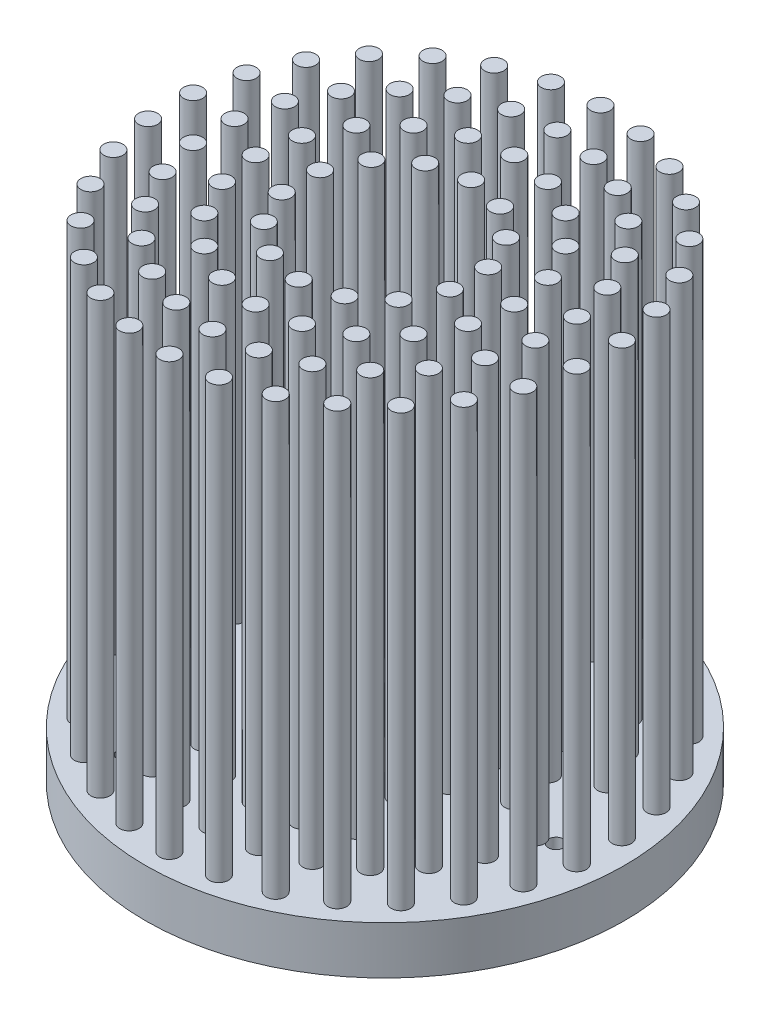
SolidWorks part; units mm, degrees
ref_plane "前基準面" through (0, 0, 0) normal (0, 0, 1) x (1, 0, 0)
ref_plane "上基準面" through (0, 0, 0) normal (0, 1, 0) x (1, 0, 0)
ref_plane "右基準面" through (0, 0, 0) normal (1, 0, 0) x (0, 0, -1)
sketch "草圖1" plane through (0, 0, 0) normal (0, 1, 0) x (1, 0, 0)
  circle A0 centre (0, 0) radius 25
  dimension "D1" = 50
extrude "填料-伸長1" add sketch "草圖1" along normal blind 3
sketch "草圖2" plane through (0, 3, 0) normal (0, 1, 0) x (1, 0, 0)
  line L0 (0, 0) -> (0, 50000) construction
  circle A0 centre (0, 0) radius 1
  circle A1 centre (0, -4.5) radius 1
  circle A2 centre (0, -9) radius 1
  circle A3 centre (0, -13.5) radius 1
  circle A4 centre (0, -18) radius 1
  circle A5 centre (-4.3077, -17.477) radius 1
  circle A6 centre (-8.365, -15.9382) radius 1
  circle A7 centre (-11.9362, -13.4732) radius 1
  circle A8 centre (-14.8137, -10.2252) radius 1
  circle A9 centre (-16.8303, -6.3829) radius 1
  circle A10 centre (-17.8688, -2.1697) radius 1
  circle A11 centre (-17.8688, 2.1697) radius 1
  circle A12 centre (-16.8303, 6.3829) radius 1
  circle A13 centre (-14.8137, 10.2252) radius 1
  circle A14 centre (-11.9362, 13.4732) radius 1
  circle A15 centre (-8.365, 15.9382) radius 1
  circle A16 centre (-4.3077, 17.477) radius 1
  circle A17 centre (0, 18) radius 1
  circle A18 centre (4.3077, 17.477) radius 1
  circle A19 centre (8.365, 15.9382) radius 1
  circle A20 centre (11.9362, 13.4732) radius 1
  circle A21 centre (14.8137, 10.2252) radius 1
  circle A22 centre (16.8303, 6.3829) radius 1
  circle A23 centre (17.8688, 2.1697) radius 1
  circle A24 centre (17.8688, -2.1697) radius 1
  circle A25 centre (16.8303, -6.3829) radius 1
  circle A26 centre (14.8137, -10.2252) radius 1
  circle A27 centre (11.9362, -13.4732) radius 1
  circle A28 centre (8.365, -15.9382) radius 1
  circle A29 centre (4.3077, -17.477) radius 1
  circle A30 centre (-4.1717, -12.8393) radius 1
  circle A31 centre (-7.9351, -10.9217) radius 1
  circle A32 centre (-10.9217, -7.9351) radius 1
  circle A33 centre (-12.8393, -4.1717) radius 1
  circle A34 centre (-13.5, 0) radius 1
  circle A35 centre (-12.8393, 4.1717) radius 1
  circle A36 centre (-10.9217, 7.9351) radius 1
  circle A37 centre (-7.9351, 10.9217) radius 1
  circle A38 centre (-4.1717, 12.8393) radius 1
  circle A39 centre (0, 13.5) radius 1
  circle A40 centre (4.1717, 12.8393) radius 1
  circle A41 centre (7.9351, 10.9217) radius 1
  circle A42 centre (10.9217, 7.9351) radius 1
  circle A43 centre (12.8393, 4.1717) radius 1
  circle A44 centre (13.5, 0) radius 1
  circle A45 centre (12.8393, -4.1717) radius 1
  circle A46 centre (10.9217, -7.9351) radius 1
  circle A47 centre (7.9351, -10.9217) radius 1
  circle A48 centre (4.1717, -12.8393) radius 1
  circle A49 centre (-3.905, -8.1087) radius 1
  circle A50 centre (-7.0365, -5.6114) radius 1
  circle A51 centre (-8.7744, -2.0027) radius 1
  circle A52 centre (-8.7744, 2.0027) radius 1
  circle A53 centre (-7.0365, 5.6114) radius 1
  circle A54 centre (-3.905, 8.1087) radius 1
  circle A55 centre (0, 9) radius 1
  circle A56 centre (3.905, 8.1087) radius 1
  circle A57 centre (7.0365, 5.6114) radius 1
  circle A58 centre (8.7744, 2.0027) radius 1
  circle A59 centre (8.7744, -2.0027) radius 1
  circle A60 centre (7.0365, -5.6114) radius 1
  circle A61 centre (3.905, -8.1087) radius 1
  circle A62 centre (-3.5182, -2.8057) radius 1
  circle A63 centre (-4.3872, 1.0013) radius 1
  circle A64 centre (-1.9525, 4.0544) radius 1
  circle A65 centre (1.9525, 4.0544) radius 1
  circle A66 centre (4.3872, 1.0013) radius 1
  circle A67 centre (3.5182, -2.8057) radius 1
  circle A68 centre (0, 22.5) radius 1
  circle A69 centre (4.678, 22.0083) radius 1
  circle A70 centre (9.1516, 20.5548) radius 1
  circle A71 centre (13.2252, 18.2029) radius 1
  circle A72 centre (16.7208, 15.0554) radius 1
  circle A73 centre (19.4856, 11.25) radius 1
  circle A74 centre (21.3988, 6.9529) radius 1
  circle A75 centre (22.3767, 2.3519) radius 1
  circle A76 centre (22.3767, -2.3519) radius 1
  circle A77 centre (21.3988, -6.9529) radius 1
  circle A78 centre (19.4856, -11.25) radius 1
  circle A79 centre (16.7208, -15.0554) radius 1
  circle A80 centre (13.2252, -18.2029) radius 1
  circle A81 centre (9.1516, -20.5548) radius 1
  circle A82 centre (4.678, -22.0083) radius 1
  circle A83 centre (0, -22.5) radius 1
  circle A84 centre (-4.678, -22.0083) radius 1
  circle A85 centre (-9.1516, -20.5548) radius 1
  circle A86 centre (-13.2252, -18.2029) radius 1
  circle A87 centre (-16.7208, -15.0554) radius 1
  circle A88 centre (-19.4856, -11.25) radius 1
  circle A89 centre (-21.3988, -6.9529) radius 1
  circle A90 centre (-22.3767, -2.3519) radius 1
  circle A91 centre (-22.3767, 2.3519) radius 1
  circle A92 centre (-21.3988, 6.9529) radius 1
  circle A93 centre (-19.4856, 11.25) radius 1
  circle A94 centre (-16.7208, 15.0554) radius 1
  circle A95 centre (-13.2252, 18.2029) radius 1
  circle A96 centre (-9.1516, 20.5548) radius 1
  circle A97 centre (-4.678, 22.0083) radius 1
  dimension "D1" = 5
  dimension "D4" = 26
  dimension "D3" = 4
  dimension "D6" = 30
  dimension "D7" = 20
  dimension "D2" = 5
  dimension "D5" = 4.5
extrude "填料-伸長2" add sketch "草圖2" along normal blind 27
sketch "草圖3" [suppressed] plane through (0, 3, 0) normal (0, 1, 0) x (1, 0, 0)
  circle A1 centre (0, 0) radius 25
  circle A2 centre (0, 0) radius 25
  dimension "D1" = 0
extrude "填料-伸長3" [suppressed] add sketch "草圖3" along normal blind 2
sketch "草圖4" plane through (0, 3, 0) normal (0, 1, 0) x (1, 0, 0)
  circle A1 centre (0, 22.5) radius 1
  circle A2 centre (0, 22.5) radius 1
  circle A3 centre (-4.3077, -17.477) radius 1
  circle A4 centre (-4.3077, -17.477) radius 1
  circle A5 centre (0, -18) radius 1
  circle A6 centre (0, -18) radius 1
  circle A7 centre (0, -13.5) radius 1
  circle A8 centre (0, -13.5) radius 1
  circle A9 centre (0, -9) radius 1
  circle A10 centre (0, -9) radius 1
  circle A11 centre (0, -4.5) radius 1
  circle A12 centre (0, -4.5) radius 1
  circle A13 centre (0, 0) radius 1
  circle A14 centre (0, 0) radius 1
  circle A15 centre (-14.8137, 10.2252) radius 1
  circle A16 centre (-14.8137, 10.2252) radius 1
  circle A17 centre (-16.8303, 6.3829) radius 1
  circle A18 centre (-16.8303, 6.3829) radius 1
  circle A19 centre (-17.8688, 2.1697) radius 1
  circle A20 centre (-17.8688, 2.1697) radius 1
  circle A21 centre (-17.8688, -2.1697) radius 1
  circle A22 centre (-17.8688, -2.1697) radius 1
  circle A23 centre (-16.8303, -6.3829) radius 1
  circle A24 centre (-16.8303, -6.3829) radius 1
  circle A25 centre (-14.8137, -10.2252) radius 1
  circle A26 centre (-14.8137, -10.2252) radius 1
  circle A27 centre (-11.9362, -13.4732) radius 1
  circle A28 centre (-11.9362, -13.4732) radius 1
  circle A29 centre (-8.365, -15.9382) radius 1
  circle A30 centre (-8.365, -15.9382) radius 1
  circle A31 centre (14.8137, 10.2252) radius 1
  circle A32 centre (14.8137, 10.2252) radius 1
  circle A33 centre (11.9362, 13.4732) radius 1
  circle A34 centre (11.9362, 13.4732) radius 1
  circle A35 centre (8.365, 15.9382) radius 1
  circle A36 centre (8.365, 15.9382) radius 1
  circle A37 centre (4.3077, 17.477) radius 1
  circle A38 centre (4.3077, 17.477) radius 1
  circle A39 centre (0, 18) radius 1
  circle A40 centre (0, 18) radius 1
  circle A41 centre (-4.3077, 17.477) radius 1
  circle A42 centre (-4.3077, 17.477) radius 1
  circle A43 centre (-8.365, 15.9382) radius 1
  circle A44 centre (-8.365, 15.9382) radius 1
  circle A45 centre (-11.9362, 13.4732) radius 1
  circle A46 centre (-11.9362, 13.4732) radius 1
  circle A47 centre (4.3077, -17.477) radius 1
  circle A48 centre (4.3077, -17.477) radius 1
  circle A49 centre (8.365, -15.9382) radius 1
  circle A50 centre (8.365, -15.9382) radius 1
  circle A51 centre (11.9362, -13.4732) radius 1
  circle A52 centre (11.9362, -13.4732) radius 1
  circle A53 centre (14.8137, -10.2252) radius 1
  circle A54 centre (14.8137, -10.2252) radius 1
  circle A55 centre (16.8303, -6.3829) radius 1
  circle A56 centre (16.8303, -6.3829) radius 1
  circle A57 centre (17.8688, -2.1697) radius 1
  circle A58 centre (17.8688, -2.1697) radius 1
  circle A59 centre (17.8688, 2.1697) radius 1
  circle A60 centre (17.8688, 2.1697) radius 1
  circle A61 centre (16.8303, 6.3829) radius 1
  circle A62 centre (16.8303, 6.3829) radius 1
  circle A63 centre (-7.9351, 10.9217) radius 1
  circle A64 centre (-7.9351, 10.9217) radius 1
  circle A65 centre (-10.9217, 7.9351) radius 1
  circle A66 centre (-10.9217, 7.9351) radius 1
  circle A67 centre (-12.8393, 4.1717) radius 1
  circle A68 centre (-12.8393, 4.1717) radius 1
  circle A69 centre (-13.5, 0) radius 1
  circle A70 centre (-13.5, 0) radius 1
  circle A71 centre (-12.8393, -4.1717) radius 1
  circle A72 centre (-12.8393, -4.1717) radius 1
  circle A73 centre (-10.9217, -7.9351) radius 1
  circle A74 centre (-10.9217, -7.9351) radius 1
  circle A75 centre (-7.9351, -10.9217) radius 1
  circle A76 centre (-7.9351, -10.9217) radius 1
  circle A77 centre (-4.1717, -12.8393) radius 1
  circle A78 centre (-4.1717, -12.8393) radius 1
  circle A79 centre (12.8393, -4.1717) radius 1
  circle A80 centre (12.8393, -4.1717) radius 1
  circle A81 centre (13.5, 0) radius 1
  circle A82 centre (13.5, 0) radius 1
  circle A83 centre (12.8393, 4.1717) radius 1
  circle A84 centre (12.8393, 4.1717) radius 1
  circle A85 centre (10.9217, 7.9351) radius 1
  circle A86 centre (10.9217, 7.9351) radius 1
  circle A87 centre (7.9351, 10.9217) radius 1
  circle A88 centre (7.9351, 10.9217) radius 1
  circle A89 centre (4.1717, 12.8393) radius 1
  circle A90 centre (4.1717, 12.8393) radius 1
  circle A91 centre (0, 13.5) radius 1
  circle A92 centre (0, 13.5) radius 1
  circle A93 centre (-4.1717, 12.8393) radius 1
  circle A94 centre (-4.1717, 12.8393) radius 1
  circle A95 centre (-7.0365, 5.6114) radius 1
  circle A96 centre (-7.0365, 5.6114) radius 1
  circle A97 centre (-8.7744, 2.0027) radius 1
  circle A98 centre (-8.7744, 2.0027) radius 1
  circle A99 centre (-8.7744, -2.0027) radius 1
  circle A100 centre (-8.7744, -2.0027) radius 1
  circle A101 centre (-7.0365, -5.6114) radius 1
  circle A102 centre (-7.0365, -5.6114) radius 1
  circle A103 centre (-3.905, -8.1087) radius 1
  circle A104 centre (-3.905, -8.1087) radius 1
  circle A105 centre (4.1717, -12.8393) radius 1
  circle A106 centre (4.1717, -12.8393) radius 1
  circle A107 centre (7.9351, -10.9217) radius 1
  circle A108 centre (7.9351, -10.9217) radius 1
  circle A109 centre (10.9217, -7.9351) radius 1
  circle A110 centre (10.9217, -7.9351) radius 1
  circle A111 centre (3.905, -8.1087) radius 1
  circle A112 centre (3.905, -8.1087) radius 1
  circle A113 centre (7.0365, -5.6114) radius 1
  circle A114 centre (7.0365, -5.6114) radius 1
  circle A115 centre (8.7744, -2.0027) radius 1
  circle A116 centre (8.7744, -2.0027) radius 1
  circle A117 centre (8.7744, 2.0027) radius 1
  circle A118 centre (8.7744, 2.0027) radius 1
  circle A119 centre (7.0365, 5.6114) radius 1
  circle A120 centre (7.0365, 5.6114) radius 1
  circle A121 centre (3.905, 8.1087) radius 1
  circle A122 centre (3.905, 8.1087) radius 1
  circle A123 centre (0, 9) radius 1
  circle A124 centre (0, 9) radius 1
  circle A125 centre (-3.905, 8.1087) radius 1
  circle A126 centre (-3.905, 8.1087) radius 1
  circle A127 centre (3.5182, -2.8057) radius 1
  circle A128 centre (3.5182, -2.8057) radius 1
  circle A129 centre (4.3872, 1.0013) radius 1
  circle A130 centre (4.3872, 1.0013) radius 1
  circle A131 centre (1.9525, 4.0544) radius 1
  circle A132 centre (1.9525, 4.0544) radius 1
  circle A133 centre (-1.9525, 4.0544) radius 1
  circle A134 centre (-1.9525, 4.0544) radius 1
  circle A135 centre (-4.3872, 1.0013) radius 1
  circle A136 centre (-4.3872, 1.0013) radius 1
  circle A137 centre (-3.5182, -2.8057) radius 1
  circle A138 centre (-3.5182, -2.8057) radius 1
  circle A139 centre (22.3767, -2.3519) radius 1
  circle A140 centre (22.3767, -2.3519) radius 1
  circle A141 centre (22.3767, 2.3519) radius 1
  circle A142 centre (22.3767, 2.3519) radius 1
  circle A143 centre (21.3988, 6.9529) radius 1
  circle A144 centre (21.3988, 6.9529) radius 1
  circle A145 centre (19.4856, 11.25) radius 1
  circle A146 centre (19.4856, 11.25) radius 1
  circle A147 centre (16.7208, 15.0554) radius 1
  circle A148 centre (16.7208, 15.0554) radius 1
  circle A149 centre (13.2252, 18.2029) radius 1
  circle A150 centre (13.2252, 18.2029) radius 1
  circle A151 centre (9.1516, 20.5548) radius 1
  circle A152 centre (9.1516, 20.5548) radius 1
  circle A153 centre (4.678, 22.0083) radius 1
  circle A154 centre (4.678, 22.0083) radius 1
  circle A155 centre (-4.678, -22.0083) radius 1
  circle A156 centre (-4.678, -22.0083) radius 1
  circle A157 centre (0, -22.5) radius 1
  circle A158 centre (0, -22.5) radius 1
  circle A159 centre (4.678, -22.0083) radius 1
  circle A160 centre (4.678, -22.0083) radius 1
  circle A161 centre (9.1516, -20.5548) radius 1
  circle A162 centre (9.1516, -20.5548) radius 1
  circle A163 centre (13.2252, -18.2029) radius 1
  circle A164 centre (13.2252, -18.2029) radius 1
  circle A165 centre (16.7208, -15.0554) radius 1
  circle A166 centre (16.7208, -15.0554) radius 1
  circle A167 centre (19.4856, -11.25) radius 1
  circle A168 centre (19.4856, -11.25) radius 1
  circle A169 centre (21.3988, -6.9529) radius 1
  circle A170 centre (21.3988, -6.9529) radius 1
  circle A171 centre (-21.3988, 6.9529) radius 1
  circle A172 centre (-21.3988, 6.9529) radius 1
  circle A173 centre (-22.3767, 2.3519) radius 1
  circle A174 centre (-22.3767, 2.3519) radius 1
  circle A175 centre (-22.3767, -2.3519) radius 1
  circle A176 centre (-22.3767, -2.3519) radius 1
  circle A177 centre (-21.3988, -6.9529) radius 1
  circle A178 centre (-21.3988, -6.9529) radius 1
  circle A179 centre (-19.4856, -11.25) radius 1
  circle A180 centre (-19.4856, -11.25) radius 1
  circle A181 centre (-16.7208, -15.0554) radius 1
  circle A182 centre (-16.7208, -15.0554) radius 1
  circle A183 centre (-13.2252, -18.2029) radius 1
  circle A184 centre (-13.2252, -18.2029) radius 1
  circle A185 centre (-9.1516, -20.5548) radius 1
  circle A186 centre (-9.1516, -20.5548) radius 1
  circle A187 centre (-4.678, 22.0083) radius 1
  circle A188 centre (-4.678, 22.0083) radius 1
  circle A189 centre (-9.1516, 20.5548) radius 1
  circle A190 centre (-9.1516, 20.5548) radius 1
  circle A191 centre (-13.2252, 18.2029) radius 1
  circle A192 centre (-13.2252, 18.2029) radius 1
  circle A193 centre (-16.7208, 15.0554) radius 1
  circle A194 centre (-16.7208, 15.0554) radius 1
  circle A195 centre (-19.4856, 11.25) radius 1
  circle A196 centre (-19.4856, 11.25) radius 1
  dimension "D1" = 0
  dimension "D2" = 0
  dimension "D3" = 0
  dimension "D4" = 0
  dimension "D5" = 0
  dimension "D6" = 0
  dimension "D7" = 0
  dimension "D8" = 0
  dimension "D9" = 0
  dimension "D10" = 0
  dimension "D11" = 0
  dimension "D12" = 0
  dimension "D13" = 0
  dimension "D14" = 0
  dimension "D15" = 0
  dimension "D16" = 0
  dimension "D17" = 0
  dimension "D18" = 0
  dimension "D19" = 0
  dimension "D20" = 0
  dimension "D21" = 0
  dimension "D22" = 0
  dimension "D23" = 0
  dimension "D24" = 0
  dimension "D25" = 0
  dimension "D26" = 0
  dimension "D27" = 0
  dimension "D28" = 0
  dimension "D29" = 0
  dimension "D30" = 0
  dimension "D31" = 0
  dimension "D32" = 0
  dimension "D33" = 0
  dimension "D34" = 0
  dimension "D35" = 0
  dimension "D36" = 0
  dimension "D37" = 0
  dimension "D38" = 0
  dimension "D39" = 0
  dimension "D40" = 0
  dimension "D41" = 0
  dimension "D42" = 0
  dimension "D43" = 0
  dimension "D44" = 0
  dimension "D45" = 0
  dimension "D46" = 0
  dimension "D47" = 0
  dimension "D48" = 0
  dimension "D49" = 0
  dimension "D50" = 0
  dimension "D51" = 0
  dimension "D52" = 0
  dimension "D53" = 0
  dimension "D54" = 0
  dimension "D55" = 0
  dimension "D56" = 0
  dimension "D57" = 0
  dimension "D58" = 0
  dimension "D59" = 0
  dimension "D60" = 0
  dimension "D61" = 0
  dimension "D62" = 0
  dimension "D63" = 0
  dimension "D64" = 0
  dimension "D65" = 0
  dimension "D66" = 0
  dimension "D67" = 0
  dimension "D68" = 0
  dimension "D69" = 0
  dimension "D70" = 0
  dimension "D71" = 0
  dimension "D72" = 0
  dimension "D73" = 0
  dimension "D74" = 0
  dimension "D75" = 0
  dimension "D76" = 0
  dimension "D77" = 0
  dimension "D78" = 0
  dimension "D79" = 0
  dimension "D80" = 0
  dimension "D81" = 0
  dimension "D82" = 0
  dimension "D83" = 0
  dimension "D84" = 0
  dimension "D85" = 0
  dimension "D86" = 0
  dimension "D87" = 0
  dimension "D88" = 0
  dimension "D89" = 0
  dimension "D90" = 0
  dimension "D91" = 0
  dimension "D92" = 0
  dimension "D93" = 0
  dimension "D94" = 0
  dimension "D95" = 0
  dimension "D96" = 0
  dimension "D97" = 0
  dimension "D98" = 0
extrude "填料-伸長4" [suppressed] add sketch "草圖4" along normal blind 37
sketch "草圖5" plane through (0, 3, 0) normal (0, 1, 0) x (1, 0, 0)
  circle A1 centre (0, 0) radius 25
  circle A2 centre (0, 0) radius 25
  dimension "D1" = 0
extrude "填料-伸長5" add sketch "草圖5" along normal blind 2
sketch "草圖7" [suppressed] plane through (0, 3, 0) normal (0, 1, 0) x (1, 0, 0)
  circle A1 centre (0, 0) radius 25
  circle A2 centre (0, 0) radius 25
  dimension "D1" = 0
extrude "填料-伸長7" [suppressed] add sketch "草圖7" along normal blind 2
fillet "圓角1" [suppressed] radius 0.2
fillet "圓角2" [suppressed] radius 0.2
fillet "圓角3" [suppressed] radius 0.2
fillet "圓角5" [suppressed] radius 0.2
fillet "圓角6" [suppressed] radius 0.2
hole_wizard "M2x0.4 Tapped Hole1" positions "Sketch3" profile "Sketch2" tap size "M2x0.4" standard "Ansi 公制"
sketch "Sketch3" plane through (0, 0, 0) normal (0, -1, 0) x (1, 0, 0)
  line L0 (0, 0) -> (-8.3595, -17.6173) construction
  line L2 (0, 0) -> (19.4368, 1.5691) construction
  line L4 (0, 0) -> (-11.0773, 16.0482) construction
  line L5 (-8.365, 15.9382) -> (-11.9362, 13.4732) construction
  line L7 (-10.1506, 14.7057) -> (-11.9362, 17.2926) construction
  circle A0 centre (0, 0) radius 19.5 construction
  point P0 (-11.0773, 16.0482)
  point P1 (19.4368, 1.5691)
  point P4 (-8.3595, -17.6173)
  dimension "D3" = 39
  dimension "D1" = 120
  dimension "D2" = 120
sketch "Sketch2" plane through (-11.0773, 0, 16.0482) normal (1, 0, 0) x (0, 0, -1)
  line L0 (0, 0) -> (0, 6.4807)
  line L1 (0, 6.4807) -> (0.8, 6)
  line L2 (0.8, 6) -> (0.8, 0)
  line L5 (0.8, 0) -> (0, 0)
  line L10 (0, 6.4807) -> (-0.8, 6) construction
  line L11 (0, -6.35) -> (0, 107.95) construction
  dimension "螺孔鑽直徑" = 1.6
  dimension "螺孔鑽深度" = 6
  dimension "導頭角度" = 118
sketch "Sketch4" [suppressed] plane through (0, 5, 0) normal (0, 1, 0) x (1, 0, 0)
  circle A0 centre (-14.8137, 10.2252) radius 1
  circle A1 centre (14.8137, 10.2252) radius 1
  circle A2 centre (0, -18) radius 1
  arc A3 (-15.6405, 9.6627) -> (-15.8029, 10.3715) centre (-14.8137, 10.2252) ccw construction
  arc A4 (15.8029, 10.3715) -> (15.6405, 9.6627) centre (14.8137, 10.2252) ccw construction
  arc A7 (0.8268, -18.5625) -> (-0.8268, -18.5625) centre (0, -18) ccw construction
  circle A8 centre (0, -18) radius 1 construction
extrude "Extrude3" [suppressed] cut sketch "Sketch4" along normal through all
sketch "草圖6" plane through (0, 5, 0) normal (0, 1, 0) x (1, 0, 0)
  circle A1 centre (0, 22.5) radius 1
  circle A2 centre (0, 22.5) radius 1
  circle A3 centre (-4.3077, -17.477) radius 1
  circle A4 centre (-4.3077, -17.477) radius 1
  circle A5 centre (0, -18) radius 1
  circle A6 centre (0, -18) radius 1
  circle A7 centre (0, -13.5) radius 1
  circle A8 centre (0, -13.5) radius 1
  circle A9 centre (0, -9) radius 1
  circle A10 centre (0, -9) radius 1
  circle A11 centre (0, -4.5) radius 1
  circle A12 centre (0, -4.5) radius 1
  circle A13 centre (0, 0) radius 1
  circle A14 centre (0, 0) radius 1
  circle A15 centre (-14.8137, 10.2252) radius 1
  circle A16 centre (-14.8137, 10.2252) radius 1
  circle A17 centre (-16.8303, 6.3829) radius 1
  circle A18 centre (-16.8303, 6.3829) radius 1
  circle A19 centre (-17.8688, 2.1697) radius 1
  circle A20 centre (-17.8688, 2.1697) radius 1
  circle A21 centre (-17.8688, -2.1697) radius 1
  circle A22 centre (-17.8688, -2.1697) radius 1
  circle A23 centre (-16.8303, -6.3829) radius 1
  circle A24 centre (-16.8303, -6.3829) radius 1
  circle A25 centre (-14.8137, -10.2252) radius 1
  circle A26 centre (-14.8137, -10.2252) radius 1
  circle A27 centre (-11.9362, -13.4732) radius 1
  circle A28 centre (-11.9362, -13.4732) radius 1
  circle A29 centre (-8.365, -15.9382) radius 1
  circle A30 centre (-8.365, -15.9382) radius 1
  circle A31 centre (14.8137, 10.2252) radius 1
  circle A32 centre (14.8137, 10.2252) radius 1
  circle A33 centre (11.9362, 13.4732) radius 1
  circle A34 centre (11.9362, 13.4732) radius 1
  circle A35 centre (8.365, 15.9382) radius 1
  circle A36 centre (8.365, 15.9382) radius 1
  circle A37 centre (4.3077, 17.477) radius 1
  circle A38 centre (4.3077, 17.477) radius 1
  circle A39 centre (0, 18) radius 1
  circle A40 centre (0, 18) radius 1
  circle A41 centre (-4.3077, 17.477) radius 1
  circle A42 centre (-4.3077, 17.477) radius 1
  circle A43 centre (-8.365, 15.9382) radius 1
  circle A44 centre (-8.365, 15.9382) radius 1
  circle A45 centre (-11.9362, 13.4732) radius 1
  circle A46 centre (-11.9362, 13.4732) radius 1
  circle A47 centre (4.3077, -17.477) radius 1
  circle A48 centre (4.3077, -17.477) radius 1
  circle A49 centre (8.365, -15.9382) radius 1
  circle A50 centre (8.365, -15.9382) radius 1
  circle A51 centre (11.9362, -13.4732) radius 1
  circle A52 centre (11.9362, -13.4732) radius 1
  circle A53 centre (14.8137, -10.2252) radius 1
  circle A54 centre (14.8137, -10.2252) radius 1
  circle A55 centre (16.8303, -6.3829) radius 1
  circle A56 centre (16.8303, -6.3829) radius 1
  circle A57 centre (17.8688, -2.1697) radius 1
  circle A58 centre (17.8688, -2.1697) radius 1
  circle A59 centre (17.8688, 2.1697) radius 1
  circle A60 centre (17.8688, 2.1697) radius 1
  circle A61 centre (16.8303, 6.3829) radius 1
  circle A62 centre (16.8303, 6.3829) radius 1
  circle A63 centre (-7.9351, 10.9217) radius 1
  circle A64 centre (-7.9351, 10.9217) radius 1
  circle A65 centre (-10.9217, 7.9351) radius 1
  circle A66 centre (-10.9217, 7.9351) radius 1
  circle A67 centre (-12.8393, 4.1717) radius 1
  circle A68 centre (-12.8393, 4.1717) radius 1
  circle A69 centre (-13.5, 0) radius 1
  circle A70 centre (-13.5, 0) radius 1
  circle A71 centre (-12.8393, -4.1717) radius 1
  circle A72 centre (-12.8393, -4.1717) radius 1
  circle A73 centre (-10.9217, -7.9351) radius 1
  circle A74 centre (-10.9217, -7.9351) radius 1
  circle A75 centre (-7.9351, -10.9217) radius 1
  circle A76 centre (-7.9351, -10.9217) radius 1
  circle A77 centre (-4.1717, -12.8393) radius 1
  circle A78 centre (-4.1717, -12.8393) radius 1
  circle A79 centre (12.8393, -4.1717) radius 1
  circle A80 centre (12.8393, -4.1717) radius 1
  circle A81 centre (13.5, 0) radius 1
  circle A82 centre (13.5, 0) radius 1
  circle A83 centre (12.8393, 4.1717) radius 1
  circle A84 centre (12.8393, 4.1717) radius 1
  circle A85 centre (10.9217, 7.9351) radius 1
  circle A86 centre (10.9217, 7.9351) radius 1
  circle A87 centre (7.9351, 10.9217) radius 1
  circle A88 centre (7.9351, 10.9217) radius 1
  circle A89 centre (4.1717, 12.8393) radius 1
  circle A90 centre (4.1717, 12.8393) radius 1
  circle A91 centre (0, 13.5) radius 1
  circle A92 centre (0, 13.5) radius 1
  circle A93 centre (-4.1717, 12.8393) radius 1
  circle A94 centre (-4.1717, 12.8393) radius 1
  circle A95 centre (-7.0365, 5.6114) radius 1
  circle A96 centre (-7.0365, 5.6114) radius 1
  circle A97 centre (-8.7744, 2.0027) radius 1
  circle A98 centre (-8.7744, 2.0027) radius 1
  circle A99 centre (-8.7744, -2.0027) radius 1
  circle A100 centre (-8.7744, -2.0027) radius 1
  circle A101 centre (-7.0365, -5.6114) radius 1
  circle A102 centre (-7.0365, -5.6114) radius 1
  circle A103 centre (-3.905, -8.1087) radius 1
  circle A104 centre (-3.905, -8.1087) radius 1
  circle A105 centre (4.1717, -12.8393) radius 1
  circle A106 centre (4.1717, -12.8393) radius 1
  circle A107 centre (7.9351, -10.9217) radius 1
  circle A108 centre (7.9351, -10.9217) radius 1
  circle A109 centre (10.9217, -7.9351) radius 1
  circle A110 centre (10.9217, -7.9351) radius 1
  circle A111 centre (3.905, -8.1087) radius 1
  circle A112 centre (3.905, -8.1087) radius 1
  circle A113 centre (7.0365, -5.6114) radius 1
  circle A114 centre (7.0365, -5.6114) radius 1
  circle A115 centre (8.7744, -2.0027) radius 1
  circle A116 centre (8.7744, -2.0027) radius 1
  circle A117 centre (8.7744, 2.0027) radius 1
  circle A118 centre (8.7744, 2.0027) radius 1
  circle A119 centre (7.0365, 5.6114) radius 1
  circle A120 centre (7.0365, 5.6114) radius 1
  circle A121 centre (3.905, 8.1087) radius 1
  circle A122 centre (3.905, 8.1087) radius 1
  circle A123 centre (0, 9) radius 1
  circle A124 centre (0, 9) radius 1
  circle A125 centre (-3.905, 8.1087) radius 1
  circle A126 centre (-3.905, 8.1087) radius 1
  circle A127 centre (3.5182, -2.8057) radius 1
  circle A128 centre (3.5182, -2.8057) radius 1
  circle A129 centre (4.3872, 1.0013) radius 1
  circle A130 centre (4.3872, 1.0013) radius 1
  circle A131 centre (1.9525, 4.0544) radius 1
  circle A132 centre (1.9525, 4.0544) radius 1
  circle A133 centre (-1.9525, 4.0544) radius 1
  circle A134 centre (-1.9525, 4.0544) radius 1
  circle A135 centre (-4.3872, 1.0013) radius 1
  circle A136 centre (-4.3872, 1.0013) radius 1
  circle A137 centre (-3.5182, -2.8057) radius 1
  circle A138 centre (-3.5182, -2.8057) radius 1
  circle A139 centre (22.3767, -2.3519) radius 1
  circle A140 centre (22.3767, -2.3519) radius 1
  circle A141 centre (22.3767, 2.3519) radius 1
  circle A142 centre (22.3767, 2.3519) radius 1
  circle A143 centre (21.3988, 6.9529) radius 1
  circle A144 centre (21.3988, 6.9529) radius 1
  circle A145 centre (19.4856, 11.25) radius 1
  circle A146 centre (19.4856, 11.25) radius 1
  circle A147 centre (16.7208, 15.0554) radius 1
  circle A148 centre (16.7208, 15.0554) radius 1
  circle A149 centre (13.2252, 18.2029) radius 1
  circle A150 centre (13.2252, 18.2029) radius 1
  circle A151 centre (9.1516, 20.5548) radius 1
  circle A152 centre (9.1516, 20.5548) radius 1
  circle A153 centre (4.678, 22.0083) radius 1
  circle A154 centre (4.678, 22.0083) radius 1
  circle A155 centre (-4.678, -22.0083) radius 1
  circle A156 centre (-4.678, -22.0083) radius 1
  circle A157 centre (0, -22.5) radius 1
  circle A158 centre (0, -22.5) radius 1
  circle A159 centre (4.678, -22.0083) radius 1
  circle A160 centre (4.678, -22.0083) radius 1
  circle A161 centre (9.1516, -20.5548) radius 1
  circle A162 centre (9.1516, -20.5548) radius 1
  circle A163 centre (13.2252, -18.2029) radius 1
  circle A164 centre (13.2252, -18.2029) radius 1
  circle A165 centre (16.7208, -15.0554) radius 1
  circle A166 centre (16.7208, -15.0554) radius 1
  circle A167 centre (19.4856, -11.25) radius 1
  circle A168 centre (19.4856, -11.25) radius 1
  circle A169 centre (21.3988, -6.9529) radius 1
  circle A170 centre (21.3988, -6.9529) radius 1
  circle A171 centre (-21.3988, 6.9529) radius 1
  circle A172 centre (-21.3988, 6.9529) radius 1
  circle A173 centre (-22.3767, 2.3519) radius 1
  circle A174 centre (-22.3767, 2.3519) radius 1
  circle A175 centre (-22.3767, -2.3519) radius 1
  circle A176 centre (-22.3767, -2.3519) radius 1
  circle A177 centre (-21.3988, -6.9529) radius 1
  circle A178 centre (-21.3988, -6.9529) radius 1
  circle A179 centre (-19.4856, -11.25) radius 1
  circle A180 centre (-19.4856, -11.25) radius 1
  circle A181 centre (-16.7208, -15.0554) radius 1
  circle A182 centre (-16.7208, -15.0554) radius 1
  circle A183 centre (-13.2252, -18.2029) radius 1
  circle A184 centre (-13.2252, -18.2029) radius 1
  circle A185 centre (-9.1516, -20.5548) radius 1
  circle A186 centre (-9.1516, -20.5548) radius 1
  circle A187 centre (-4.678, 22.0083) radius 1
  circle A188 centre (-4.678, 22.0083) radius 1
  circle A189 centre (-9.1516, 20.5548) radius 1
  circle A190 centre (-9.1516, 20.5548) radius 1
  circle A191 centre (-13.2252, 18.2029) radius 1
  circle A192 centre (-13.2252, 18.2029) radius 1
  circle A193 centre (-16.7208, 15.0554) radius 1
  circle A194 centre (-16.7208, 15.0554) radius 1
  circle A195 centre (-19.4856, 11.25) radius 1
  circle A196 centre (-19.4856, 11.25) radius 1
  dimension "D1" = 0
  dimension "D2" = 0
  dimension "D3" = 0
  dimension "D4" = 0
  dimension "D5" = 0
  dimension "D6" = 0
  dimension "D7" = 0
  dimension "D8" = 0
  dimension "D9" = 0
  dimension "D10" = 0
  dimension "D11" = 0
  dimension "D12" = 0
  dimension "D13" = 0
  dimension "D14" = 0
  dimension "D15" = 0
  dimension "D16" = 0
  dimension "D17" = 0
  dimension "D18" = 0
  dimension "D19" = 0
  dimension "D20" = 0
  dimension "D21" = 0
  dimension "D22" = 0
  dimension "D23" = 0
  dimension "D24" = 0
  dimension "D25" = 0
  dimension "D26" = 0
  dimension "D27" = 0
  dimension "D28" = 0
  dimension "D29" = 0
  dimension "D30" = 0
  dimension "D31" = 0
  dimension "D32" = 0
  dimension "D33" = 0
  dimension "D34" = 0
  dimension "D35" = 0
  dimension "D36" = 0
  dimension "D37" = 0
  dimension "D38" = 0
  dimension "D39" = 0
  dimension "D40" = 0
  dimension "D41" = 0
  dimension "D42" = 0
  dimension "D43" = 0
  dimension "D44" = 0
  dimension "D45" = 0
  dimension "D46" = 0
  dimension "D47" = 0
  dimension "D48" = 0
  dimension "D49" = 0
  dimension "D50" = 0
  dimension "D51" = 0
  dimension "D52" = 0
  dimension "D53" = 0
  dimension "D54" = 0
  dimension "D55" = 0
  dimension "D56" = 0
  dimension "D57" = 0
  dimension "D58" = 0
  dimension "D59" = 0
  dimension "D60" = 0
  dimension "D61" = 0
  dimension "D62" = 0
  dimension "D63" = 0
  dimension "D64" = 0
  dimension "D65" = 0
  dimension "D66" = 0
  dimension "D67" = 0
  dimension "D68" = 0
  dimension "D69" = 0
  dimension "D70" = 0
  dimension "D71" = 0
  dimension "D72" = 0
  dimension "D73" = 0
  dimension "D74" = 0
  dimension "D75" = 0
  dimension "D76" = 0
  dimension "D77" = 0
  dimension "D78" = 0
  dimension "D79" = 0
  dimension "D80" = 0
  dimension "D81" = 0
  dimension "D82" = 0
  dimension "D83" = 0
  dimension "D84" = 0
  dimension "D85" = 0
  dimension "D86" = 0
  dimension "D87" = 0
  dimension "D88" = 0
  dimension "D89" = 0
  dimension "D90" = 0
  dimension "D91" = 0
  dimension "D92" = 0
  dimension "D93" = 0
  dimension "D94" = 0
  dimension "D95" = 0
  dimension "D96" = 0
  dimension "D97" = 0
  dimension "D98" = 0
extrude "填料-伸長6" add sketch "草圖6" along normal blind 45
sketch "Sketch5" plane through (0, 0, 0) normal (0, -1, 0) x (1, 0, 0)
  circle A0 centre (0, 0) radius 5.75
  dimension "D1" = 11.5
extrude "Extrude4" cut sketch "Sketch5" against normal through all
